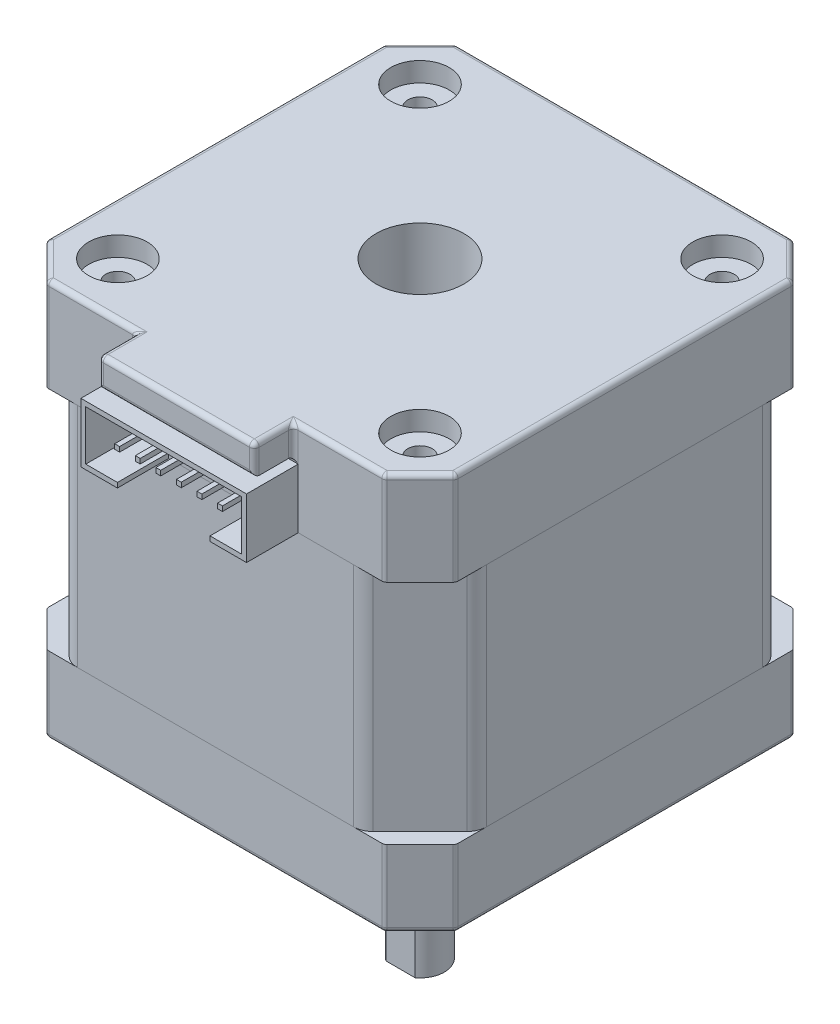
SolidWorks part; units mm, degrees
ref_plane "Front Plane" through (0, 0, 0) normal (0, 0, 1) x (1, 0, 0)
ref_plane "Top Plane" through (0, 0, 0) normal (0, 1, 0) x (1, 0, 0)
ref_plane "Right Plane" through (0, 0, 0) normal (1, 0, 0) x (0, 0, -1)
sketch "Sketch1" plane through (0, 0, 0) normal (0, 1, 0) x (1, 0, 0)
  line L0 (8, -21) -> (21, -21)
  line L1 (-21, 21) -> (21, 21)
  line L2 (-21, 21) -> (-21, -21)
  line L3 (-21, -21) -> (-8, -21)
  line L4 (21, 21) -> (21, -21)
  line L5 (-21, 21) -> (21, -21) construction
  line L6 (-21, -21) -> (21, 21) construction
  line L8 (8, -21) -> (8, -25)
  line L9 (8, -25) -> (-8, -25)
  line L10 (-8, -21) -> (-8, -25)
  point P0 (0, 0)
  point P10 (0, -25)
  dimension "D1" = 42
  dimension "D2" = 42
  dimension "D3" = 16
  dimension "D4" = 4
extrude "Boss-Extrude1" add sketch "Sketch1" along normal blind 9.6
chamfer "Chamfer1" distance 3.7 angle 45 4 edges at (-21, 4.8, -21) (21, 4.8, -21) (-21, 4.8, 21) (21, 4.8, 21)
sketch "Sketch26" plane through (8, 0, 0) normal (1, 0, 0) x (0, 0, -1)
  line L0 (-25, 9.6) -> (-25, 0) construction
  line L2 (-21, 0) -> (-25, 0)
  line L3 (-21, 0) -> (-21, 6.6)
  line L4 (-21, 6.6) -> (-25, 6.6)
  line L5 (-25, 0) -> (-25, 6.6)
  line L6 (-25, 9.6) -> (-21, 9.6) construction
  dimension "D1" = 3
extrude "Cut-Extrude10" cut sketch "Sketch26" against normal up to surface (16 mm away)
fillet "Fillet13" radius 0.5 12 edges at (8, 9.6, 23) (0, 9.6, 25) (-8, 9.6, 23) (-12.65, 9.6, 21) (-19.15, 9.6, 19.15) (-21, 9.6, 0) (-19.15, 9.6, -19.15) (0, 9.6, -21) (19.15, 9.6, -19.15) (21, 9.6, 0) (19.15, 9.6, 19.15) (12.65, 9.6, 21)
fillet "Fillet14" radius 0.5 26 edges at (-7.8536, 9.4536, 24.8536) (7.8536, 9.4536, 24.8536) (7.8536, 9.4536, 20.8536) (-7.8536, 9.4536, 20.8536) (-17.2393, 9.4536, 20.8536) (-20.8536, 9.4536, 17.2393) (-20.8536, 9.4536, -17.2393) (-17.2393, 9.4536, -20.8536) (17.2393, 9.4536, -20.8536) (20.8536, 9.4536, -17.2393) (20.8536, 9.4536, 17.2393) (17.2393, 9.4536, 20.8536) (0, 6.6, 25) (-8, 7.85, 25) (8, 7.85, 25) (8, 7.85, 21) (0, 6.6, 21) (-8, 7.85, 21) (-17.3, 4.55, 21) (-21, 4.55, 17.3) (-21, 4.55, -17.3) (-17.3, 4.55, -21) (17.3, 4.55, -21) (21, 4.55, -17.3) (21, 4.55, 17.3) (17.3, 4.55, 21)
sketch "Sketch28" plane through (0, 0, 21) normal (0, 0, 1) x (1, 0, 0)
  line L0 (-17.0929, 0) -> (17.0929, 0) construction
  line L1 (8.5, 6.1) -> (-8.5, 6.1)
  line L2 (8.5, 6.1) -> (8.5, 0)
  line L3 (8.5, 0) -> (-8.5, 0)
  line L4 (-8.5, 6.1) -> (-8.5, 0)
  line L5 (-8.5, 6.1) -> (-8.5, 9.1) construction
  point P7 (-8.5, 3.05)
extrude "Cut-Extrude11" cut sketch "Sketch28" against normal blind 3
sketch "Sketch2" plane through (0, 9.6, 0) normal (0, 1, 0) x (1, 0, 0)
  line L1 (-15.5, 15.5) -> (15.5, 15.5) construction
  line L2 (-15.5, 15.5) -> (-15.5, -15.5) construction
  line L3 (-15.5, -15.5) -> (15.5, -15.5) construction
  line L4 (15.5, 15.5) -> (15.5, -15.5) construction
  line L5 (-15.5, 15.5) -> (15.5, -15.5) construction
  line L6 (-15.5, -15.5) -> (15.5, 15.5) construction
  circle A0 centre (-15.5, 15.5) radius 1.25
  circle A1 centre (15.5, 15.5) radius 1.25
  circle A2 centre (15.5, -15.5) radius 1.25
  circle A3 centre (-15.5, -15.5) radius 1.25
  point P0 (0, 0)
  dimension "D3" = 2.5
  dimension "D1" = 31
  dimension "D2" = 31
extrude "Cut-Extrude1" cut sketch "Sketch2" against normal blind 7.85
sketch "Sketch3" plane through (0, 9.6, 0) normal (0, 1, 0) x (1, 0, 0)
  circle A0 centre (-15.5, 15.5) radius 3
  circle A1 centre (15.5, 15.5) radius 3
  circle A2 centre (15.5, -15.5) radius 3
  circle A3 centre (-15.5, -15.5) radius 3
  dimension "D1" = 6
extrude "Cut-Extrude2" cut sketch "Sketch3" against normal blind 2
sketch "Sketch4" plane through (0, 9.6, 0) normal (0, 1, 0) x (1, 0, 0)
  circle A0 centre (0, 0) radius 4.5
  dimension "D1" = 9
extrude "Cut-Extrude3" cut sketch "Sketch4" against normal through all
shell "Shell1" thickness 3
sketch "Sketch5" plane through (0, 0, 0) normal (0, -1, 0) x (1, 0, 0)
  line L1 (-21, 21) -> (21, 21)
  line L2 (-21, 21) -> (-21, -21)
  line L3 (-21, -21) -> (21, -21)
  line L4 (21, 21) -> (21, -21)
  line L5 (-21, 21) -> (21, -21) construction
  line L6 (-21, -21) -> (21, 21) construction
  line L7 (21, 17.0929) -> (21, -17.0929) construction
  point P0 (0, 0)
extrude "Boss-Extrude2" add sketch "Sketch5" along normal blind 23.3 separate body
chamfer "Chamfer2" distance 6 angle 45 4 edges at (21, -11.65, 21) (21, -11.65, -21) (-21, -11.65, -21) (-21, -11.65, 21)
fillet "Fillet3" radius 2 8 edges at (-15, -11.65, -21) (-21, -11.65, -15) (-21, -11.65, 15) (-15, -11.65, 21) (15, -11.65, 21) (21, -11.65, 15) (15, -11.65, -21) (21, -11.65, -15)
sketch "Sketch6" plane through (0, -23.3, 0) normal (0, -1, 0) x (1, 0, 0)
  line L0 (21, 17.0929) -> (21, -17.0929) construction
  line L1 (-21, 21) -> (21, 21)
  line L2 (-21, 21) -> (-21, -21)
  line L3 (-21, -21) -> (21, -21)
  line L4 (21, 21) -> (21, -21)
  line L5 (-21, 21) -> (21, -21) construction
  line L6 (-21, -21) -> (21, 21) construction
  line L7 (-14.1716, -21) -> (14.1716, -21) construction
  point P0 (0, 0)
extrude "Boss-Extrude3" add sketch "Sketch6" along normal blind 7.9 separate body
chamfer "Chamfer3" distance 3.7 angle 45 4 edges at (-21, -27.25, 21) (-21, -27.25, -21) (21, -27.25, -21) (21, -27.25, 21)
fillet "Fillet4" radius 0.5 8 edges at (-17.3, -27.25, -21) (17.3, -27.25, -21) (21, -27.25, -17.3) (21, -27.25, 17.3) (17.3, -27.25, 21) (-17.3, -27.25, 21) (-21, -27.25, 17.3) (-21, -27.25, -17.3)
fillet "Fillet5" radius 0.5 16 edges at (-20.9619, -31.2, -17.2842) (-21, -31.2, 0) (-20.9619, -31.2, 17.2842) (-19.15, -31.2, 19.15) (-17.2842, -31.2, 20.9619) (0, -31.2, 21) (17.2842, -31.2, 20.9619) (19.15, -31.2, 19.15) (20.9619, -31.2, 17.2842) (21, -31.2, 0) (20.9619, -31.2, -17.2842) (19.15, -31.2, -19.15) (17.2842, -31.2, -20.9619) (0, -31.2, -21) (-17.2842, -31.2, -20.9619) (-19.15, -31.2, -19.15)
sketch "Sketch7" plane through (0, -31.2, 0) normal (0, -1, 0) x (1, 0, 0)
  line L1 (15.5, 15.5) -> (-15.5, 15.5) construction
  line L2 (15.5, 15.5) -> (15.5, -15.5) construction
  line L3 (15.5, -15.5) -> (-15.5, -15.5) construction
  line L4 (-15.5, 15.5) -> (-15.5, -15.5) construction
  line L5 (15.5, 15.5) -> (-15.5, -15.5) construction
  line L6 (15.5, -15.5) -> (-15.5, 15.5) construction
  circle A0 centre (15.5, 15.5) radius 1.25
  circle A1 centre (15.5, -15.5) radius 1.25
  circle A2 centre (-15.5, -15.5) radius 1.25
  circle A3 centre (-15.5, 15.5) radius 1.25
  point P0 (0, 0)
  dimension "D3" = 2.5
  dimension "D1" = 31
  dimension "D2" = 31
extrude "Cut-Extrude4" cut sketch "Sketch7" against normal blind 4.8
thread "Thread1" pitch 0.5 start angle 0, offset 0, length 10, pitch 0.5, diameter 2.5
ref_plane "Plane1" through (16.75, -31.2, 15.5) normal (0, 0, 1) x (1, 0, 0)
sketch "Thread Profile1" plane through (16.75, -31.2, 15.5) normal (0, 0, 1) x (1, 0, 0)
  line L0 (0, 0) -> (0, 0.5) construction
  line L1 (0, 0) -> (0.2706, 0.1562)
  line L2 (0.2706, 0.1562) -> (0.2706, 0.2187)
  line L3 (0.2706, 0.2187) -> (0, 0.375)
  line L4 (0.2706, 0.1875) -> (0, 0.1875) construction
  line L11 (0, 0) -> (0, 0.375)
  point P2 (0, 0)
  dimension "Pitch" = 0.5
  dimension "Profile_Angle" = 60
  dimension "Profile_Land" = 0.0625
  dimension "Profile_Height" = 0.2706
thread "Thread2" pitch 0.5 start angle 0, offset 0, length 10, pitch 0.5, diameter 2.5
ref_plane "Plane2" through (16.75, -31.2, -15.5) normal (0, 0, 1) x (1, 0, 0)
sketch "Thread Profile2" plane through (16.75, -31.2, -15.5) normal (0, 0, 1) x (1, 0, 0)
  line L0 (0, 0) -> (0, 0.5) construction
  line L1 (0, 0) -> (0.2706, 0.1562)
  line L2 (0.2706, 0.1562) -> (0.2706, 0.2187)
  line L3 (0.2706, 0.2187) -> (0, 0.375)
  line L4 (0.2706, 0.1875) -> (0, 0.1875) construction
  line L11 (0, 0) -> (0, 0.375)
  point P2 (0, 0)
  dimension "Pitch" = 0.5
  dimension "Profile_Angle" = 60
  dimension "Profile_Land" = 0.0625
  dimension "Profile_Height" = 0.2706
thread "Thread3" pitch 0.5 start angle 0, offset 0, length 10, pitch 0.5, diameter 2.5
ref_plane "Plane3" through (-14.25, -31.2, 15.5) normal (0, 0, 1) x (1, 0, 0)
sketch "Thread Profile3" plane through (-14.25, -31.2, 15.5) normal (0, 0, 1) x (1, 0, 0)
  line L0 (0, 0) -> (0, 0.5) construction
  line L1 (0, 0) -> (0.2706, 0.1562)
  line L2 (0.2706, 0.1562) -> (0.2706, 0.2187)
  line L3 (0.2706, 0.2187) -> (0, 0.375)
  line L4 (0.2706, 0.1875) -> (0, 0.1875) construction
  line L11 (0, 0) -> (0, 0.375)
  point P2 (0, 0)
  dimension "Pitch" = 0.5
  dimension "Profile_Angle" = 60
  dimension "Profile_Land" = 0.0625
  dimension "Profile_Height" = 0.2706
thread "Thread4" pitch 0.5 start angle 0, offset 0, length 10, pitch 0.5, diameter 2.5
ref_plane "Plane4" through (-14.25, -31.2, -15.5) normal (0, 0, 1) x (1, 0, 0)
sketch "Thread Profile4" plane through (-14.25, -31.2, -15.5) normal (0, 0, 1) x (1, 0, 0)
  line L0 (0, 0) -> (0, 0.5) construction
  line L1 (0, 0) -> (0.2706, 0.1562)
  line L2 (0.2706, 0.1562) -> (0.2706, 0.2187)
  line L3 (0.2706, 0.2187) -> (0, 0.375)
  line L4 (0.2706, 0.1875) -> (0, 0.1875) construction
  line L11 (0, 0) -> (0, 0.375)
  point P2 (0, 0)
  dimension "Pitch" = 0.5
  dimension "Profile_Angle" = 60
  dimension "Profile_Land" = 0.0625
  dimension "Profile_Height" = 0.2706
sketch "Sketch17" plane through (0, -31.2, 0) normal (0, -1, 0) x (1, 0, 0)
  circle A0 centre (0, 0) radius 11
  dimension "D1" = 22
extrude "Boss-Extrude4" add sketch "Sketch17" along normal blind 1.9
fillet "Fillet7" radius 0.5 1 edges at (0, -31.2, -11)
chamfer "Chamfer4" distance 0.2 angle 45 1 edges at (0, -33.1, -11)
sketch "Sketch18" plane through (0, -33.1, 0) normal (0, -1, 0) x (1, 0, 0)
  circle A0 centre (0, 0) radius 4.5
  dimension "D1" = 9
extrude "Cut-Extrude5" cut sketch "Sketch18" against normal up to surface (9.8 mm away)
fillet "Fillet8" radius 0.5 1 edges at (0, -33.1, -4.5)
ref_plane "Plane5" through (0, -29.1, 0) normal (0, -1, 0) x (-1, 0, 0)
sketch "Sketch19" plane through (0, -29.1, 0) normal (0, -1, 0) x (-1, 0, 0)
  circle A0 centre (0, 0) radius 4.5 construction
  circle A1 centre (0, 0) radius 4.5
extrude "Boss-Extrude5" add sketch "Sketch19" against normal blind 1.9 separate body
sketch "Sketch20" plane through (0, -29.1, 0) normal (0, -1, 0) x (1, 0, 0)
  circle A0 centre (0, 0) radius 2.5
  dimension "D1" = 5
extrude "Boss-Extrude6" add sketch "Sketch20" along normal blind 23.45 separate body
sketch "Sketch21" plane through (0, -52.55, 0) normal (0, -1, 0) x (1, 0, 0)
  line L0 (-1.5, 2) -> (1.5, 2)
  circle A0 centre (0, 0) radius 2.5 construction
  arc A1 (1.5, 2) -> (-1.5, 2) centre (0, 0) ccw
  dimension "D1" = 3
extrude "Cut-Extrude6" cut sketch "Sketch21" against normal blind 18
sketch "Sketch30" plane through (0, 0, 18) normal (0, 0, 1) x (1, 0, 0)
  line L1 (8.5, 0) -> (-8.5, 0)
  line L2 (8.5, 0) -> (8.5, 6.1)
  line L3 (8.5, 6.1) -> (-8.5, 6.1)
  line L4 (-8.5, 0) -> (-8.5, 6.1)
extrude "Boss-Extrude8" add sketch "Sketch30" along normal blind 8.3 separate body
shell "Shell2" thickness 0.5
sketch "Sketch31" plane through (0, 0, 0) normal (0, -1, 0) x (1, 0, 0)
  line L0 (-8.5, 26.3) -> (8.5, 26.3) construction
  line L1 (-4.75, 26.3) -> (4.75, 26.3)
  line L2 (-4.75, 26.3) -> (-4.75, 21.0342)
  line L3 (-4.75, 21.0342) -> (4.75, 21.0342)
  line L4 (4.75, 26.3) -> (4.75, 21.0342)
  line L5 (8.5, 26.3) -> (8.5, 18) construction
  line L6 (-8.5, 26.3) -> (-8.5, 18) construction
  dimension "D1" = 3.75
  dimension "D2" = 3.75
extrude "Cut-Extrude12" cut sketch "Sketch31" against normal up to surface (0.5 mm away)
sketch "Sketch32" plane through (0, 0, 18.5) normal (0, 0, 1) x (1, 0, 0)
  line L0 (-5.275, 3.05) -> (5.275, 3.05) construction
  line L1 (-8, 0.5) -> (-4.75, 0.5) construction
  line L2 (8, 5.6) -> (-8, 5.6) construction
  line L3 (-3.415, 3.3) -> (-2.915, 3.3)
  line L4 (-5.525, 3.3) -> (-5.025, 3.3)
  line L5 (-5.525, 3.3) -> (-5.525, 2.8)
  line L6 (-5.525, 2.8) -> (-5.025, 2.8)
  line L7 (-5.025, 3.3) -> (-5.025, 2.8)
  line L8 (-5.525, 3.3) -> (-5.025, 2.8) construction
  line L9 (-5.525, 2.8) -> (-5.025, 3.3) construction
  line L10 (-3.415, 3.3) -> (-3.415, 2.8)
  line L11 (-3.415, 2.8) -> (-2.915, 2.8)
  line L12 (-2.915, 3.3) -> (-2.915, 2.8)
  line L13 (-3.415, 3.3) -> (-2.915, 2.8) construction
  line L14 (-3.415, 2.8) -> (-2.915, 3.3) construction
  line L15 (-1.305, 3.3) -> (-0.805, 3.3)
  line L16 (-1.305, 3.3) -> (-1.305, 2.8)
  line L17 (-1.305, 2.8) -> (-0.805, 2.8)
  line L18 (-0.805, 3.3) -> (-0.805, 2.8)
  line L19 (-1.305, 3.3) -> (-0.805, 2.8) construction
  line L20 (-1.305, 2.8) -> (-0.805, 3.3) construction
  line L21 (0.805, 3.3) -> (1.305, 3.3)
  line L22 (0.805, 3.3) -> (0.805, 2.8)
  line L23 (0.805, 2.8) -> (1.305, 2.8)
  line L24 (1.305, 3.3) -> (1.305, 2.8)
  line L25 (0.805, 3.3) -> (1.305, 2.8) construction
  line L26 (0.805, 2.8) -> (1.305, 3.3) construction
  line L27 (2.915, 3.3) -> (3.415, 3.3)
  line L28 (2.915, 3.3) -> (2.915, 2.8)
  line L29 (2.915, 2.8) -> (3.415, 2.8)
  line L30 (3.415, 3.3) -> (3.415, 2.8)
  line L31 (2.915, 3.3) -> (3.415, 2.8) construction
  line L32 (2.915, 2.8) -> (3.415, 3.3) construction
  line L33 (5.025, 3.3) -> (5.525, 3.3)
  line L34 (5.025, 3.3) -> (5.025, 2.8)
  line L35 (5.025, 2.8) -> (5.525, 2.8)
  line L36 (5.525, 3.3) -> (5.525, 2.8)
  line L37 (5.025, 3.3) -> (5.525, 2.8) construction
  line L38 (5.025, 2.8) -> (5.525, 3.3) construction
  point P2 (0, 3.05)
  dimension "D1" = 10.55
  dimension "D2" = 0.5
  dimension "D3" = 0.5
  dimension "D4" = 6
extrude "Boss-Extrude9" add sketch "Sketch32" along normal blind 7.3 separate body
